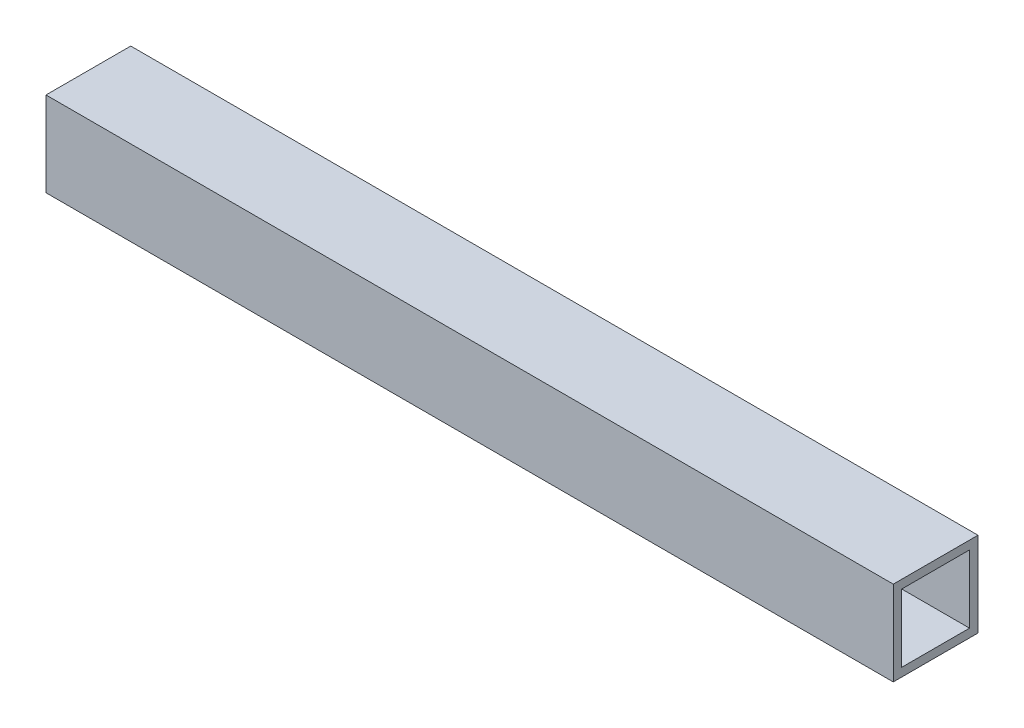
SolidWorks part; units mm, degrees
ref_plane "Plan de face" through (0, 0, 0) normal (0, 0, 1) x (1, 0, 0)
ref_plane "Plan de dessus" through (0, 0, 0) normal (0, 1, 0) x (1, 0, 0)
ref_plane "Plan de droite" through (0, 0, 0) normal (1, 0, 0) x (0, 0, -1)
sketch "Esquisse1" plane through (0, 0, 0) normal (1, 0, 0) x (0, 0, -1)
  line L0 (0, 10) -> (10, 0) construction
  line L1 (0, 0) -> (10, 0)
  line L2 (0, 0) -> (0, 10)
  line L3 (0, 10) -> (10, 10)
  line L4 (10, 0) -> (10, 10)
  line L5 (1, 1) -> (9, 1)
  line L6 (1, 1) -> (1, 9)
  line L7 (1, 9) -> (9, 9)
  line L8 (9, 1) -> (9, 9)
  line L9 (1, 1) -> (9, 9) construction
  point P9 (5, 5)
  point P10 (0, 0)
  dimension "D1" = 10
  dimension "D2" = 8
extrude "Boss.-Extru.1" add sketch "Esquisse1" along normal blind 100
